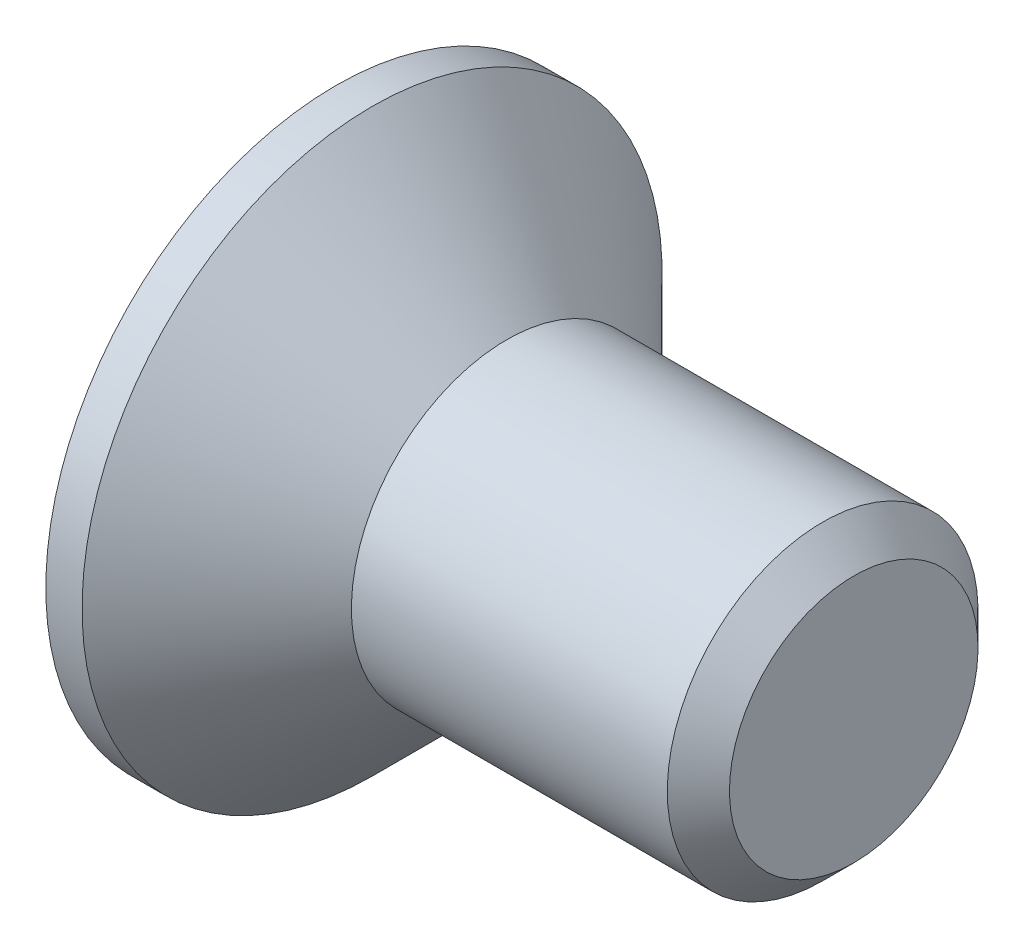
SolidWorks part; units mm, degrees
ref_plane "Front Plane" through (0, 0, 0) normal (0, 0, 1) x (1, 0, 0)
ref_plane "Top Plane" through (0, 0, 0) normal (0, 1, 0) x (1, 0, 0)
ref_plane "Right Plane" through (0, 0, 0) normal (1, 0, 0) x (0, 0, -1)
sketch "Sketch1" plane through (0, 0, 0) normal (0, 0, 1) x (1, 0, 0)
  line L1 (-1.65, 2.8) -> (-1.65, 0)
  line L2 (-1.65, 0) -> (3.35, 0)
  line L3 (3.35, 0) -> (3.35, 1.5)
  line L4 (3.35, 1.5) -> (0, 1.5)
  line L5 (-1.65, 2.8) -> (-1.3, 2.8)
  line L6 (-1.3, 2.8) -> (0, 1.5)
  dimension "D1" = 1.5
  dimension "D2" = 45
  dimension "D3" = 1.65
  dimension "D4" = 5
  dimension "D5" = 2.8
revolve "Revolve1" add sketch "Sketch1" angle 360 about L2
chamfer "Chamfer1" distance 0.3 angle 45 1 edges at (3.35, -1.5, 0)
sketch "Sketch2" plane through (-1.65, 0, 0) normal (-1, 0, 0) x (0, 0, 1)
  line L0 (-0.365, 1.45) -> (0.365, 1.45)
  line L1 (0.365, 1.45) -> (0.365, 0.365)
  line L2 (0.365, 0.365) -> (1.45, 0.365)
  line L3 (1.45, 0.365) -> (1.45, -0.365)
  line L4 (1.45, -0.365) -> (0.365, -0.365)
  line L5 (0.365, -0.365) -> (0.365, -1.45)
  line L6 (0.365, -1.45) -> (-0.365, -1.45)
  line L7 (-0.365, -1.45) -> (-0.365, -0.365)
  line L8 (-0.365, -0.365) -> (-1.45, -0.365)
  line L9 (-1.45, -0.365) -> (-1.45, 0.365)
  line L10 (-1.45, 0.365) -> (-0.365, 0.365)
  line L11 (-0.365, 0.365) -> (-0.365, 1.45)
  point P2 (0, 1.45)
  point P14 (0, -1.45)
  point P15 (1.45, 0)
  point P16 (-1.45, 0)
  dimension "D1" = 2.9
  dimension "D2" = 0.73
extrude "Cut-Extrude1" cut sketch "Sketch2" against normal blind 1.25
